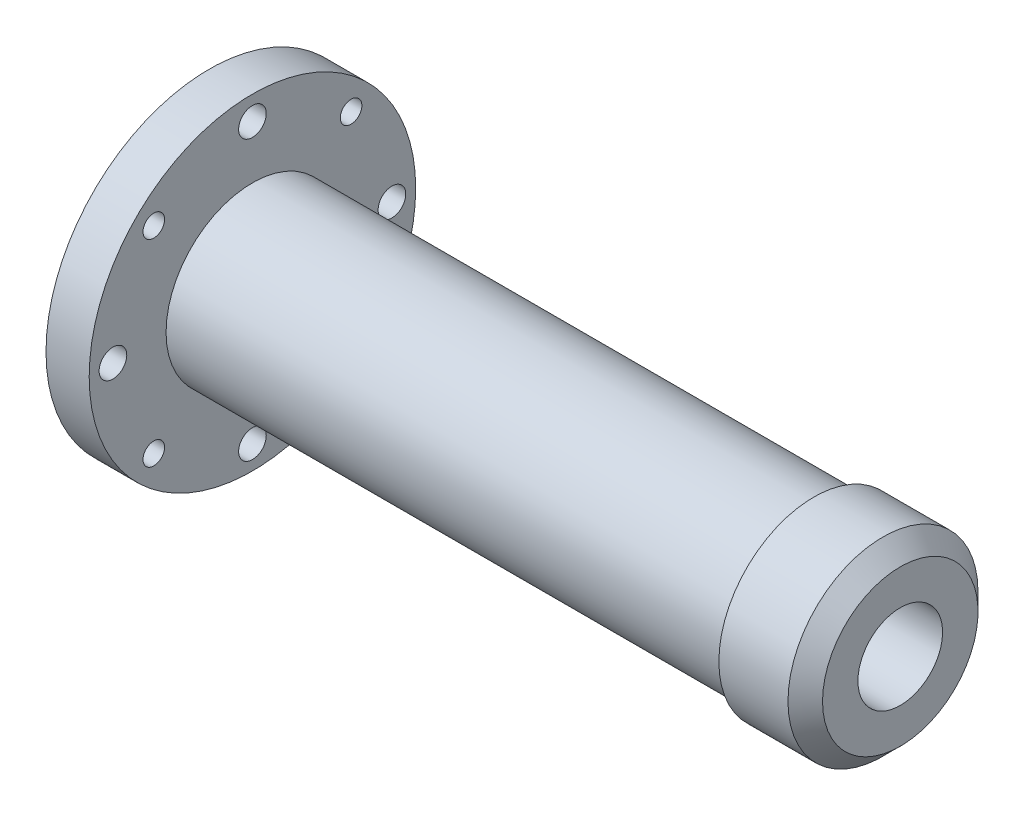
SolidWorks part; units mm, degrees
ref_plane "Vorne" through (0, 0, 0) normal (0, 0, 1) x (1, 0, 0)
ref_plane "Oben" through (0, 0, 0) normal (0, 1, 0) x (1, 0, 0)
ref_plane "Rechts" through (0, 0, 0) normal (1, 0, 0) x (0, 0, -1)
sketch "Skizze1" plane through (0, 0, 0) normal (0, 0, 1) x (1, 0, 0)
  line L0 (0, 0) -> (48.0903, 0) construction
  line L1 (0, 5) -> (15, 5)
  line L2 (15, 5) -> (15, 4.9)
  line L3 (15, 4.9) -> (80, 4.9)
  line L4 (0, 5) -> (0, 10)
  line L5 (0, 10) -> (4.3, 10)
  line L6 (4.3, 10) -> (4.3, 13.5)
  line L7 (4.3, 13.5) -> (0, 13.5)
  line L8 (0, 13.5) -> (0, 18.9)
  line L9 (0, 18.9) -> (5, 18.9)
  line L10 (5, 18.9) -> (5, 10)
  line L11 (5, 10) -> (70, 10)
  line L12 (70, 10) -> (70, 11)
  line L13 (70, 11) -> (78, 11)
  line L14 (80, 9) -> (80, 4.9)
  line L15 (78, 11) -> (80, 9)
  dimension "D1" = 10
  dimension "D2" = 9.8
  dimension "D3" = 20
  dimension "D4" = 22
  dimension "D5" = 20
  dimension "D6" = 27
  dimension "D7" = 37.8
  dimension "D8" = 15
  dimension "D9" = 5
  dimension "D10" = 4.3
  dimension "D11" = 80
  dimension "D12" = 2
  dimension "D13" = 45
  dimension "D14" = 10
revolve "Rotation1" add sketch "Skizze1" angle 360 about L0
hole_wizard "Ø3.2 (3.2) Durchmesser Bohrung1" positions "Skizze3" profile "Skizze4" hole size "Ø3.2" standard "ISO"
sketch "Skizze3" plane through (5, 0, 0) normal (1, 0, 0) x (0, 0, -1)
  line L2 (0, 0) -> (16.15, 0) construction
  point P6 (16.15, 0)
  dimension "D1" = 16.15
sketch "Skizze4" plane through (5, 0, -16.15) normal (0, 1, 0) x (0, 0, -1)
  line L0 (0, 0) -> (0, 5.001)
  line L1 (0, 5.001) -> (1.6, 5.001)
  line L2 (1.6, 5.001) -> (1.6, 0)
  line L5 (1.6, 0) -> (0, 0)
  line L11 (0, -6.35) -> (0, 107.95) construction
  dimension "Bohrerdurchmesser" = 3.2
  dimension "Bohrungstiefe" = 5.001
hole_wizard "M2.5 Gewindebohrung1" positions "Skizze6" profile "Skizze5" tap size "M2.5" standard "ISO"
sketch "Skizze6" plane through (0, 0, 0) normal (-1, 0, 0) x (0, 0, 1)
  point P0 (0, 7.5)
  dimension "D1" = 7.5
sketch "Skizze5" plane through (0, 7.5, 0) normal (0, 1, 0) x (0, 0, 1)
  line L0 (0, 0) -> (0, 7.8659)
  line L1 (0, 7.8659) -> (1.025, 7.25)
  line L2 (1.025, 7.25) -> (1.025, 0)
  line L5 (1.025, 0) -> (0, 0)
  line L10 (0, 7.8659) -> (-1.025, 7.25) construction
  line L11 (0, -6.35) -> (0, 107.95) construction
  dimension "Bohrerdurchmesser" = 2.05
  dimension "Bohrungstiefe" = 7.25
  dimension "Spitzenwinkel" = 118
hole_wizard "M3 Gewindebohrung1" positions "Skizze8" profile "Skizze9" tap size "M3" standard "ISO"
sketch "Skizze8" plane through (0, 0, 0) normal (-1, 0, 0) x (0, 0, 1)
  line L0 (-11.4198, 11.4198) -> (0, 0) construction
  line L1 (0, 0) -> (-17, 0) construction
  point P0 (-11.4198, 11.4198)
  dimension "D1" = 45
  dimension "D2" = 16.15
sketch "Skizze9" plane through (0, 11.4198, -11.4198) normal (0, 1, 0) x (0, 0, 1)
  line L0 (0, 0) -> (0, 5.001)
  line L1 (0, 5.001) -> (1.25, 5.001)
  line L2 (1.25, 5.001) -> (1.25, 0)
  line L5 (1.25, 0) -> (0, 0)
  line L11 (0, -6.35) -> (0, 107.95) construction
  dimension "Bohrerdurchmesser" = 2.5
  dimension "Bohrungstiefe" = 5.001
pattern_circular "Kreismuster3" count 4 over 360 about axis through (0, 0, 0) along (1, 0, 0) of "M2.5 Gewindebohrung1", "M3 Gewindebohrung1", "Ø3.2 (3.2) Durchmesser Bohrung1"
chamfer "Fase1" distance 0.5 angle 45 1 edges at (0, 0, 5)
